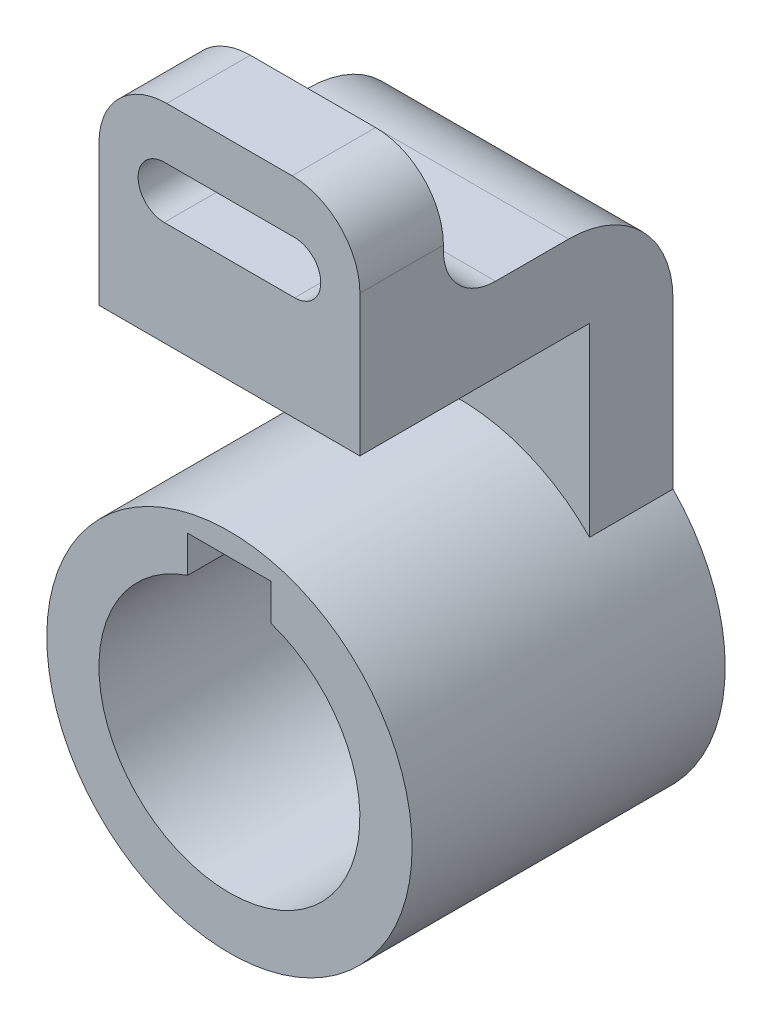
SolidWorks part; units mm, degrees
ref_plane "Front Plane" through (0, 0, 0) normal (0, 0, 1) x (1, 0, 0)
ref_plane "Top Plane" through (0, 0, 0) normal (0, 1, 0) x (1, 0, 0)
ref_plane "Right Plane" through (0, 0, 0) normal (1, 0, 0) x (0, 0, -1)
sketch "Sketch1" plane through (0, 0, 0) normal (0, 0, 1) x (1, 0, 0)
  circle A0 centre (0, 0) radius 35
  dimension "D1" = 70
extrude "Extrude1" add sketch "Sketch1" along normal blind 60
sketch "Sketch3" plane through (0, 0, 0) normal (1, 0, 0) x (0, 0, -1)
  line L0 (-16, 0) -> (-16, 60)
  line L2 (-16, 60) -> (-60, 60)
  line L3 (-60, 60) -> (-60, 100)
  line L5 (-60, 35) -> (-60, -35) construction
  line L6 (-16, 0) -> (0, 0)
  line L7 (0, 0) -> (0, 76)
  line L8 (0, 76) -> (-44, 76)
  line L9 (-44, 76) -> (-44, 100)
  line L10 (-44, 100) -> (-60, 100)
  dimension "D1" = 16
  dimension "D2" = 100
  dimension "D3" = 16
  dimension "D4" = 40
extrude "Extrude2" add sketch "Sketch3" along normal mid plane 50
sketch "Sketch4" plane through (0, 0, 60) normal (0, 0, 1) x (1, 0, 0)
  line L0 (0, 20) -> (0, 30.6854) construction
  line L1 (8, 23.6854) -> (8, 30.6854)
  line L2 (-8, 23.6854) -> (-8, 30.6854)
  line L3 (8, 20) -> (8, 30.6854) construction
  line L4 (8, 30.6854) -> (-8, 30.6854)
  line L5 (-8, 20) -> (-8, 30.6854) construction
  line L6 (0, 100) -> (0, 60) construction
  line L7 (25, 100) -> (-25, 100) construction
  line L8 (25, 60) -> (-25, 60) construction
  line L9 (-12.5, 90) -> (12.5, 90)
  line L10 (12.5, 80) -> (-12.5, 80)
  arc A0 (-8, 23.6854) -> (8, 23.6854) centre (0, 0) ccw
  arc A1 (12.5, 90) -> (12.5, 80) centre (12.5, 85) cw
  arc A2 (-12.5, 90) -> (-12.5, 80) centre (-12.5, 85) ccw
  point P21 (0, 90)
  point P23 (0, 80)
  dimension "D3" = 50
  dimension "D2" = 5
  dimension "D4" = 7
  dimension "D5" = 25
  dimension "D6" = 15
  dimension "D1" = 16
extrude "Cut-Extrude1" cut sketch "Sketch4" against normal through all
fillet "Fillet1" radius 13 2 edges at (-25, 100, 52) (25, 100, 52)
fillet "Fillet2" radius 20 1 edges at (0, 76, 0)
fillet "Fillet3" radius 10 1 edges at (0, 76, 44)
